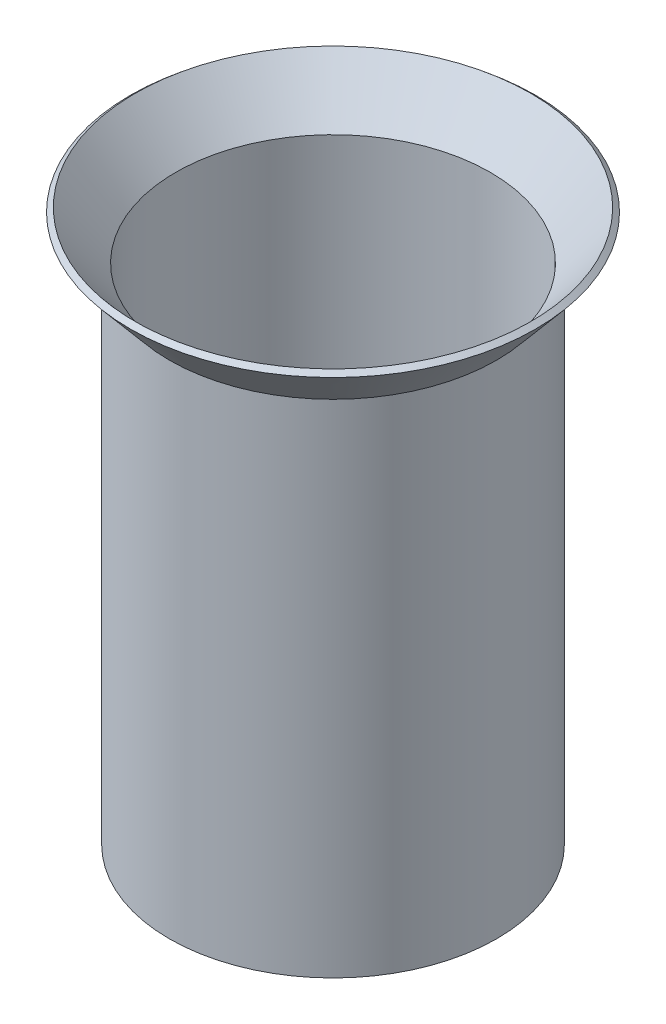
SolidWorks part; units mm, degrees
ref_plane "Ebene vorne" through (0, 0, 0) normal (0, 0, 1) x (1, 0, 0)
ref_plane "Ebene oben" through (0, 0, 0) normal (0, 1, 0) x (1, 0, 0)
ref_plane "Ebene rechts" through (0, 0, 0) normal (1, 0, 0) x (0, 0, -1)
sketch "Skizze1" plane through (0, 0, 0) normal (0, 0, 1) x (1, 0, 0)
  line L0 (0, 0) -> (0, 102.8321) construction
  line L1 (25, 0) -> (25, 80)
  line L2 (25, 80) -> (31.4279, 87.6604)
  dimension "D1" = 50
  dimension "D2" = 80
  dimension "D3" = 10
  dimension "D4" = 40
revolve "Rotation-Dünn1" add sketch "Skizze1" angle 360 about L0
